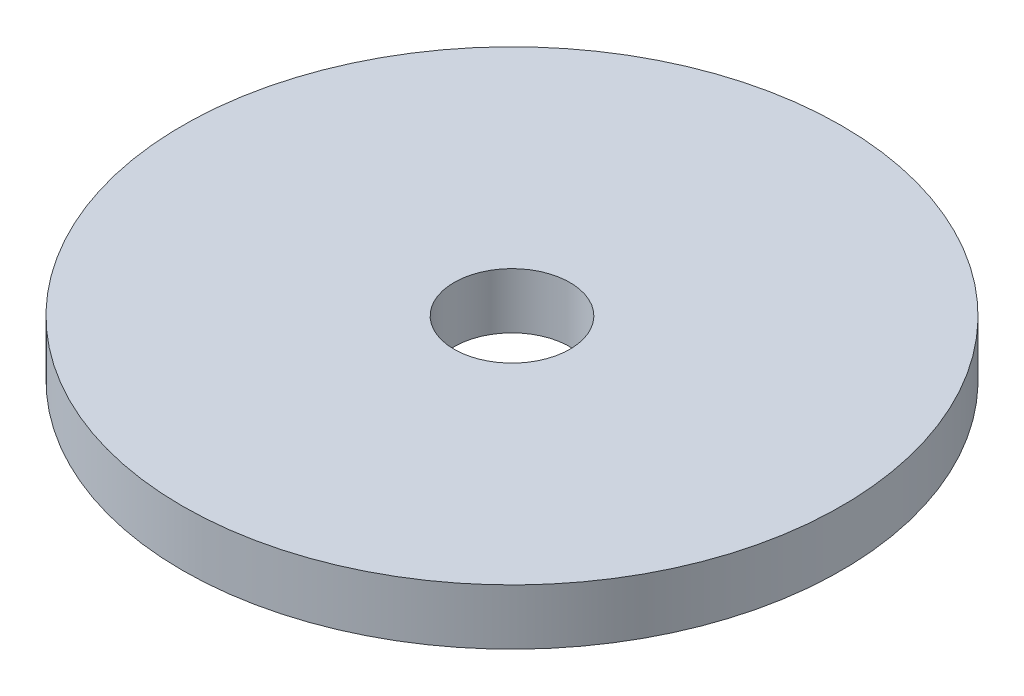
SolidWorks part; units mm, degrees
ref_plane "Front Plane" through (0, 0, 0) normal (0, 0, 1) x (1, 0, 0)
ref_plane "Top Plane" through (0, 0, 0) normal (0, 1, 0) x (1, 0, 0)
ref_plane "Right Plane" through (0, 0, 0) normal (1, 0, 0) x (0, 0, -1)
sketch "Sketch1" plane through (0, 0, 0) normal (0, 1, 0) x (1, 0, 0)
  circle A0 centre (0, 0) radius 18.796
  circle A1 centre (0, 0) radius 3.302
  dimension "D1" = 37.592
  dimension "D2" = 6.604
extrude "Boss-Extrude1" add sketch "Sketch1" along normal blind 3.175
